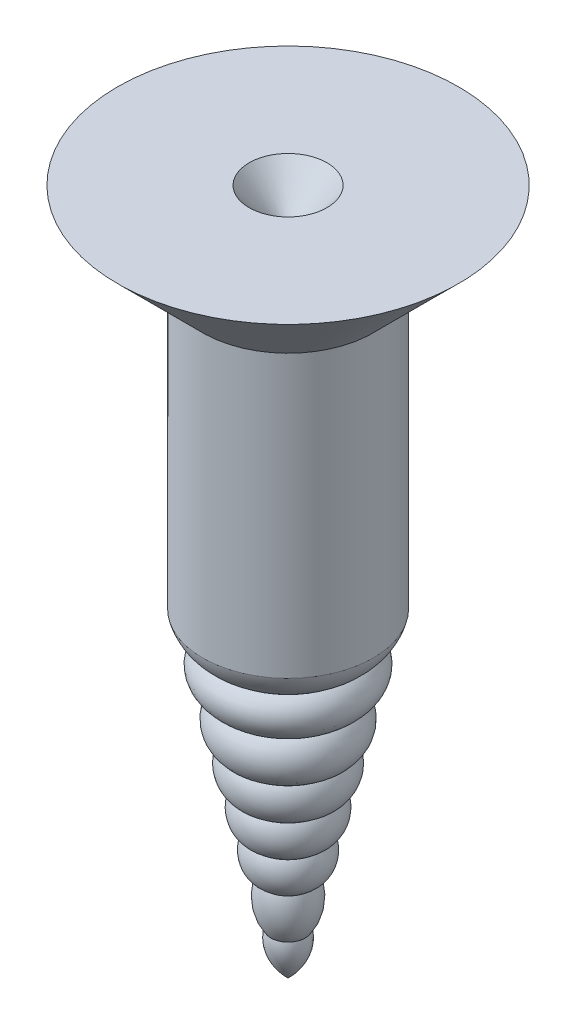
SolidWorks part; units mm, degrees
ref_plane "Front Plane" through (0, 0, 0) normal (0, 0, 1) x (1, 0, 0)
ref_plane "Top Plane" through (0, 0, 0) normal (0, 1, 0) x (1, 0, 0)
ref_plane "Right Plane" through (0, 0, 0) normal (1, 0, 0) x (0, 0, -1)
sketch "Sketch1" plane through (0, 0, 0) normal (0, 0, 1) x (1, 0, 0)
  line L0 (1.5875, -5.9544) -> (0.2, -11.9086) construction
  line L1 (0.2, -11.9086) -> (0, -11.9086) construction
  line L9 (0.7248, 0.8752) -> (0, 0)
  line L10 (1.5875, -0.7123) -> (3.175, 0.8752)
  line L11 (3.175, 0.8752) -> (0.7248, 0.8752)
  line L12 (1.5875, -0.7123) -> (1.5875, -5.9544)
  line L13 (0, 0) -> (0, -11.9086)
  ellipse E16 centre (0.3821, -9.1509) end of major axis (0.3817, -9.6412) minor radius 0.4461 (0.5974, -9.5803) -> (0.7528, -8.8781) ccw
  ellipse E17 centre (0.1756, -9.8435) end of major axis (0.1757, -9.3298) minor radius 0.4912 (0.4361, -10.2791) -> (0.5974, -9.5803) ccw
  ellipse E18 centre (0.5403, -8.4537) end of major axis (0.4724, -8.9354) minor radius 0.4523 (0.7528, -8.8781) -> (0.9112, -8.1668) ccw
  ellipse E19 centre (0.5623, -6.8727) end of major axis (1.3688, -6.814) minor radius 0.5636 (0.9859, -7.3373) -> (1.1923, -6.4962) ccw
  ellipse E20 centre (0.649, -7.7248) end of major axis (0.655, -7.2103) minor radius 0.5121 (0.9112, -8.1668) -> (0.9859, -7.3373) ccw
  ellipse E21 centre (0.3876, -5.7835) end of major axis (1.6069, -5.7901) minor radius 0.9464 (1.1923, -6.4962) -> (1.5875, -5.9544) ccw
  ellipse E22 centre (-1.8789, -11.426) end of major axis (0.3315, -11.1832) minor radius 1.1853 (0, -11.9086) -> (0.3182, -11.1063) ccw
  ellipse E23 centre (-0.2157, -10.578) end of major axis (-0.2157, -11.3942) minor radius 0.7004 (0.3182, -11.1063) -> (0.4361, -10.2791) ccw
  point P1 (0, 0)
  point P2 (0, 0)
  point P3 (0, 0)
  dimension "D1" = 0.7248
  dimension "D2" = 0.2
  dimension "D3" = 11.9086
  dimension "D4" = 5.2421
  dimension "D5" = 0.8752
  dimension "D6" = 0.7123
revolve "Revolve3" add sketch "Sketch1" angle 360 about L13
